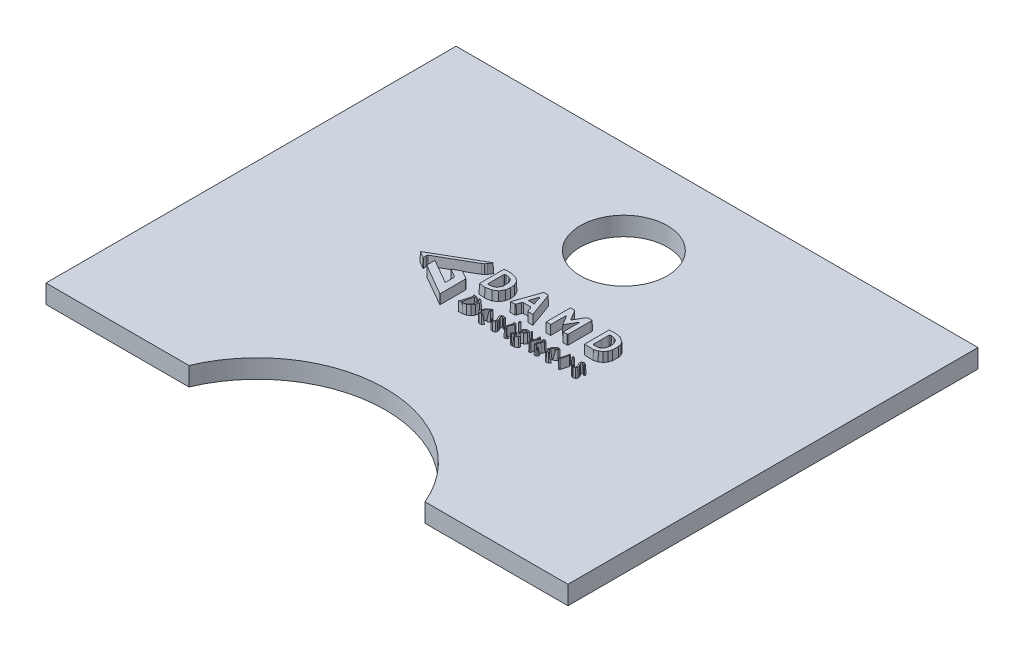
SolidWorks part; units mm, degrees
ref_plane "Front Plane" through (0, 0, 0) normal (0, 0, 1) x (1, 0, 0)
ref_plane "Top Plane" through (0, 0, 0) normal (0, 1, 0) x (1, 0, 0)
ref_plane "Right Plane" through (0, 0, 0) normal (1, 0, 0) x (0, 0, -1)
sketch "Sketch1" plane through (0, 0, 0) normal (0, 1, 0) x (1, 0, 0)
  line L0 (0, 0) -> (0, 66)
  line L1 (0, 66) -> (84, 66)
  line L2 (84, 66) -> (84, 0)
  line L3 (84, 0) -> (61, 0)
  line L4 (0, 0) -> (23, 0)
  arc A1 (23, 0) -> (61, 0) centre (42, -8) cw
  circle A2 centre (42, 51) radius 7
  dimension "D4" = 8
  dimension "D5" = 42
  dimension "D7" = 14
  dimension "D1" = 84
  dimension "D2" = 66
  dimension "D3" = 23
  dimension "D6" = 15
extrude "Boss-Extrude1" add sketch "Sketch1" along normal blind 3
sketch "Sketch14" plane through (0, 3, 0) normal (0, 1, 0) x (1, 0, 0)
  line L0 (62.5315, 12.6976) -> (23.0187, 12.6976)
  line L1 (23.0187, 12.6976) -> (23.0187, 52.3216)
  line L2 (23.0187, 52.3216) -> (23.2939, 52.3216)
  line L3 (23.2939, 52.3216) -> (62.3252, 52.3216)
  line L4 (62.3252, 52.3216) -> (62.5315, 52.3216)
  line L5 (62.5315, 52.3216) -> (62.5315, 12.6976)
  line L6 (40.8384, 30.0357) -> (41.2511, 30.3188)
  line L7 (41.2511, 30.3188) -> (41.3094, 30.6654)
  line L8 (41.3094, 30.6654) -> (41.1734, 30.7577)
  line L9 (41.1734, 30.7577) -> (40.9839, 30.7289)
  line L10 (40.9839, 30.7289) -> (40.4012, 30.2451)
  line L11 (40.4012, 30.2451) -> (40.1875, 29.5251)
  line L12 (40.1875, 29.5251) -> (40.2858, 29.2935)
  line L13 (40.2858, 29.2935) -> (40.4971, 29.189)
  line L14 (40.4971, 29.189) -> (40.8331, 29.2598)
  line L15 (40.8331, 29.2598) -> (41.0818, 29.5092)
  line L16 (41.0818, 29.5092) -> (40.7362, 29.2902)
  line L17 (40.7362, 29.2902) -> (40.4997, 29.3531)
  line L18 (40.4997, 29.3531) -> (40.4471, 29.6425)
  line L19 (40.4471, 29.6425) -> (40.5712, 29.914)
  line L20 (40.5712, 29.914) -> (40.8384, 30.0357)
  line L21 (51.4984, 29.9854) -> (52.054, 30.3426)
  line L22 (52.054, 30.3426) -> (52.0858, 30.668)
  line L23 (52.0858, 30.668) -> (51.7789, 30.7262)
  line L24 (51.7789, 30.7262) -> (51.4483, 30.5505)
  line L25 (51.4483, 30.5505) -> (51.1759, 30.2348)
  line L26 (51.1759, 30.2348) -> (50.9798, 29.4774)
  line L27 (50.9798, 29.4774) -> (51.0883, 29.2717)
  line L28 (51.0883, 29.2717) -> (51.3079, 29.189)
  line L29 (51.3079, 29.189) -> (51.63, 29.2704)
  line L30 (51.63, 29.2704) -> (51.8688, 29.4986)
  line L31 (51.8688, 29.4986) -> (51.7259, 29.3901)
  line L32 (51.7259, 29.3901) -> (51.5672, 29.3028)
  line L33 (51.5672, 29.3028) -> (51.332, 29.3101)
  line L34 (51.332, 29.3101) -> (51.2259, 29.5277)
  line L35 (51.2259, 29.5277) -> (51.2633, 29.7989)
  line L36 (51.2633, 29.7989) -> (51.4693, 29.9748)
  line L37 (51.4693, 29.9748) -> (51.4984, 29.9854)
  line L38 (47.1619, 30.7157) -> (46.7736, 30.7481)
  line L39 (46.7736, 30.7481) -> (46.429, 30.5702)
  line L40 (46.429, 30.5702) -> (46.2749, 30.1634)
  line L41 (46.2749, 30.1634) -> (46.593, 29.8796)
  line L42 (46.593, 29.8796) -> (46.6063, 29.8558)
  line L43 (46.6063, 29.8558) -> (46.3179, 29.6627)
  line L44 (46.3179, 29.6627) -> (46.2193, 29.4586)
  line L45 (46.2193, 29.4586) -> (46.3946, 29.3161)
  line L46 (46.3946, 29.3161) -> (46.8021, 29.2155)
  line L47 (46.8021, 29.2155) -> (46.9433, 29.1117)
  line L48 (46.9433, 29.1117) -> (46.8762, 28.9721)
  line L49 (46.8762, 28.9721) -> (46.3734, 28.7419)
  line L50 (46.3734, 28.7419) -> (46.1905, 28.7492)
  line L51 (46.1905, 28.7492) -> (46.0771, 28.8874)
  line L52 (46.0771, 28.8874) -> (46.1777, 29.1891)
  line L53 (46.1777, 29.1891) -> (46.2253, 29.2737)
  line L54 (46.2253, 29.2737) -> (45.958, 29.1176)
  line L55 (45.958, 29.1176) -> (45.8469, 28.8742)
  line L56 (45.8469, 28.8742) -> (46.0639, 28.7234)
  line L57 (46.0639, 28.7234) -> (46.6618, 28.7604)
  line L58 (46.6618, 28.7604) -> (47.0455, 29.0224)
  line L59 (47.0455, 29.0224) -> (47.1192, 29.2618)
  line L60 (47.1192, 29.2618) -> (46.9211, 29.4298)
  line L61 (46.9211, 29.4298) -> (46.5534, 29.5357)
  line L62 (46.5534, 29.5357) -> (46.4131, 29.6309)
  line L63 (46.4131, 29.6309) -> (46.5322, 29.7553)
  line L64 (46.5322, 29.7553) -> (46.8973, 29.922)
  line L65 (46.8973, 29.922) -> (47.2406, 30.256)
  line L66 (47.2406, 30.256) -> (47.1593, 30.721)
  line L67 (47.1593, 30.721) -> (47.2598, 30.7924)
  line L68 (47.2598, 30.7924) -> (47.4371, 30.594)
  line L69 (47.4371, 30.594) -> (47.5455, 30.6787)
  line L70 (47.5455, 30.6787) -> (47.4768, 30.8797)
  line L71 (47.4768, 30.8797) -> (47.3084, 30.881)
  line L72 (47.3084, 30.881) -> (47.1619, 30.7157)
  line L73 (33.5385, 30.7395) -> (29.6227, 32.9964)
  line L74 (29.6227, 32.9964) -> (29.62, 31.7819)
  line L75 (29.62, 31.7819) -> (29.7761, 31.5068)
  line L76 (29.7761, 31.5068) -> (34.5651, 28.7472)
  line L77 (34.5651, 28.7472) -> (34.7344, 28.6625)
  line L78 (34.7344, 28.6625) -> (34.7423, 28.7498)
  line L79 (34.7423, 28.7498) -> (34.7397, 32.7953)
  line L80 (34.7397, 32.7953) -> (34.6497, 32.9488)
  line L81 (34.6497, 32.9488) -> (33.4274, 33.6578)
  line L82 (33.4274, 33.6578) -> (33.2607, 33.6817)
  line L83 (33.2607, 33.6817) -> (32.115, 33.0202)
  line L84 (32.115, 33.0202) -> (32.3029, 32.9038)
  line L85 (32.3029, 32.9038) -> (33.4009, 32.2714)
  line L86 (33.4009, 32.2714) -> (33.5359, 32.1021)
  line L87 (33.5359, 32.1021) -> (33.5385, 30.7395)
  line L88 (50.6809, 37.2694) -> (50.0485, 37.2747)
  line L89 (50.0485, 37.2747) -> (49.7628, 37.1159)
  line L90 (49.7628, 37.1159) -> (49.0246, 35.8036)
  line L91 (49.0246, 35.8036) -> (48.8923, 35.5972)
  line L92 (48.8923, 35.5972) -> (48.7971, 35.7454)
  line L93 (48.7971, 35.7454) -> (47.961, 37.1503)
  line L94 (47.961, 37.1503) -> (47.8075, 37.2747)
  line L95 (47.8075, 37.2747) -> (47.1514, 37.28)
  line L96 (47.1514, 37.28) -> (47.1514, 33.2874)
  line L97 (47.1514, 33.2874) -> (47.9345, 33.2874)
  line L98 (47.9345, 33.2874) -> (47.9345, 35.7375)
  line L99 (47.9345, 35.7375) -> (47.9742, 35.7454)
  line L100 (47.9742, 35.7454) -> (48.9161, 34.2082)
  line L101 (48.9161, 34.2082) -> (49.8607, 35.8777)
  line L102 (49.8607, 35.8777) -> (49.9136, 35.8592)
  line L103 (49.9136, 35.8592) -> (49.9136, 33.2795)
  line L104 (49.9136, 33.2795) -> (50.4613, 33.2768)
  line L105 (50.4613, 33.2768) -> (50.6515, 33.3169)
  line L106 (50.6515, 33.3169) -> (50.6968, 33.5097)
  line L107 (50.6968, 33.5097) -> (50.6915, 37.0577)
  line L108 (50.6915, 37.0577) -> (50.6809, 37.2694)
  line L109 (36.4251, 33.2795) -> (37.4084, 33.1981)
  line L110 (37.4084, 33.1981) -> (38.3698, 33.3747)
  line L111 (38.3698, 33.3747) -> (39.0455, 33.8083)
  line L112 (39.0455, 33.8083) -> (39.4493, 34.5019)
  line L113 (39.4493, 34.5019) -> (39.5733, 35.2252)
  line L114 (39.5733, 35.2252) -> (39.489, 35.9544)
  line L115 (39.489, 35.9544) -> (39.1622, 36.6175)
  line L116 (39.1622, 36.6175) -> (38.5815, 37.0763)
  line L117 (38.5815, 37.0763) -> (37.5198, 37.3412)
  line L118 (37.5198, 37.3412) -> (36.4225, 37.2985)
  line L119 (36.4225, 37.2985) -> (36.4251, 33.2795)
  line L120 (53.3479, 33.2795) -> (54.0993, 33.1962)
  line L121 (54.0993, 33.1962) -> (54.8428, 33.2478)
  line L122 (54.8428, 33.2478) -> (55.4417, 33.4337)
  line L123 (55.4417, 33.4337) -> (55.9114, 33.7468)
  line L124 (55.9114, 33.7468) -> (56.2436, 34.1835)
  line L125 (56.2436, 34.1835) -> (56.4303, 34.74)
  line L126 (56.4303, 34.74) -> (56.4567, 35.7084)
  line L127 (56.4567, 35.7084) -> (56.3263, 36.2193)
  line L128 (56.3263, 36.2193) -> (56.0741, 36.6371)
  line L129 (56.0741, 36.6371) -> (55.2291, 37.1927)
  line L130 (55.2291, 37.1927) -> (54.2987, 37.3468)
  line L131 (54.2987, 37.3468) -> (53.3505, 37.2985)
  line L132 (53.3505, 37.2985) -> (53.3479, 33.2795)
  line L133 (45.077, 33.2742) -> (45.0638, 33.3536)
  line L134 (45.0638, 33.3536) -> (43.6774, 37.1821)
  line L135 (43.6774, 37.1821) -> (43.5583, 37.2588)
  line L136 (43.5583, 37.2588) -> (42.8624, 37.2615)
  line L137 (42.8624, 37.2615) -> (41.4363, 33.2583)
  line L138 (41.4363, 33.2583) -> (42.1983, 33.2636)
  line L139 (42.1983, 33.2636) -> (42.3095, 33.38)
  line L140 (42.3095, 33.38) -> (42.5106, 34.0097)
  line L141 (42.5106, 34.0097) -> (42.6931, 34.1473)
  line L142 (42.6931, 34.1473) -> (43.7779, 34.1473)
  line L143 (43.7779, 34.1473) -> (43.9631, 34.0124)
  line L144 (43.9631, 34.0124) -> (44.1721, 33.3853)
  line L145 (44.1721, 33.3853) -> (44.2886, 33.2769)
  line L146 (44.2886, 33.2769) -> (45.077, 33.2742)
  line L147 (28.3712, 32.3561) -> (28.3051, 32.8509)
  line L148 (28.3051, 32.8509) -> (28.3196, 33.0202)
  line L149 (28.3196, 33.0202) -> (28.4453, 33.126)
  line L150 (28.4453, 33.126) -> (33.8216, 36.2322)
  line L151 (33.8216, 36.2322) -> (34.1199, 36.4204)
  line L152 (34.1199, 36.4204) -> (34.3428, 36.6979)
  line L153 (34.3428, 36.6979) -> (34.7186, 37.3594)
  line L154 (34.7186, 37.3594) -> (27.1938, 33.007)
  line L155 (27.1938, 33.007) -> (28.3077, 32.3667)
  line L156 (28.3077, 32.3667) -> (28.3712, 32.3561)
  line L157 (37.1236, 29.2234) -> (37.7718, 29.2234)
  line L158 (37.7718, 29.2234) -> (38.3164, 29.3366)
  line L159 (38.3164, 29.3366) -> (38.7607, 29.6408)
  line L160 (38.7607, 29.6408) -> (39.0592, 30.0888)
  line L161 (39.0592, 30.0888) -> (39.1662, 30.6336)
  line L162 (39.1662, 30.6336) -> (39.0441, 31.0368)
  line L163 (39.0441, 31.0368) -> (38.682, 31.2236)
  line L164 (38.682, 31.2236) -> (37.5972, 31.2819)
  line L165 (37.5972, 31.2819) -> (37.5602, 31.2289)
  line L166 (37.5602, 31.2289) -> (37.7338, 31.1396)
  line L167 (37.7338, 31.1396) -> (37.7189, 30.967)
  line L168 (37.7189, 30.967) -> (37.3273, 29.5118)
  line L169 (37.3273, 29.5118) -> (37.1236, 29.2234)
  line L170 (48.9452, 30.1256) -> (48.9161, 30.1362)
  line L171 (48.9161, 30.1362) -> (48.9558, 30.3214)
  line L172 (48.9558, 30.3214) -> (48.9955, 30.5383)
  line L173 (48.9955, 30.5383) -> (48.928, 30.7355)
  line L174 (48.928, 30.7355) -> (48.7177, 30.7262)
  line L175 (48.7177, 30.7262) -> (48.5331, 30.538)
  line L176 (48.5331, 30.538) -> (48.4398, 30.2526)
  line L177 (48.4398, 30.2526) -> (48.6303, 30.5992)
  line L178 (48.6303, 30.5992) -> (48.7706, 30.6468)
  line L179 (48.7706, 30.6468) -> (48.8023, 30.5145)
  line L180 (48.8023, 30.5145) -> (48.76, 30.3558)
  line L181 (48.76, 30.3558) -> (48.4478, 29.234)
  line L182 (48.4478, 29.234) -> (48.678, 29.234)
  line L183 (48.678, 29.234) -> (48.7335, 29.435)
  line L184 (48.7335, 29.435) -> (48.9462, 30.0125)
  line L185 (48.9462, 30.0125) -> (49.2839, 30.5225)
  line L186 (49.2839, 30.5225) -> (49.567, 30.6468)
  line L187 (49.567, 30.6468) -> (49.5696, 30.3611)
  line L188 (49.5696, 30.3611) -> (49.2839, 29.4694)
  line L189 (49.2839, 29.4694) -> (49.3262, 29.2419)
  line L190 (49.3262, 29.2419) -> (49.5961, 29.226)
  line L191 (49.5961, 29.226) -> (49.7733, 29.3954)
  line L192 (49.7733, 29.3954) -> (49.8474, 29.6361)
  line L193 (49.8474, 29.6361) -> (49.6966, 29.3663)
  line L194 (49.6966, 29.3663) -> (49.5458, 29.2895)
  line L195 (49.5458, 29.2895) -> (49.5114, 29.4509)
  line L196 (49.5114, 29.4509) -> (49.7046, 30.0436)
  line L197 (49.7046, 30.0436) -> (49.8289, 30.4458)
  line L198 (49.8289, 30.4458) -> (49.7644, 30.711)
  line L199 (49.7644, 30.711) -> (49.4955, 30.7262)
  line L200 (49.4955, 30.7262) -> (49.1701, 30.4722)
  line L201 (49.1701, 30.4722) -> (48.9452, 30.1256)
  line L202 (56.1022, 30.7315) -> (56.1419, 30.6654)
  line L203 (56.1419, 30.6654) -> (56.1101, 30.5833)
  line L204 (56.1101, 30.5833) -> (56.1366, 30.3849)
  line L205 (56.1366, 30.3849) -> (56.2583, 30.3981)
  line L206 (56.2583, 30.3981) -> (56.2795, 30.6177)
  line L207 (56.2795, 30.6177) -> (56.1604, 30.7183)
  line L208 (56.1604, 30.7183) -> (55.8601, 30.7457)
  line L209 (55.8601, 30.7457) -> (55.6074, 30.5966)
  line L210 (55.6074, 30.5966) -> (55.5175, 30.3522)
  line L211 (55.5175, 30.3522) -> (55.6101, 30.07)
  line L212 (55.6101, 30.07) -> (55.827, 29.6917)
  line L213 (55.827, 29.6917) -> (55.7635, 29.3239)
  line L214 (55.7635, 29.3239) -> (55.4275, 29.2128)
  line L215 (55.4275, 29.2128) -> (55.4249, 29.4112)
  line L216 (55.4249, 29.4112) -> (55.3376, 29.5753)
  line L217 (55.3376, 29.5753) -> (55.245, 29.5541)
  line L218 (55.245, 29.5541) -> (55.2344, 29.3636)
  line L219 (55.2344, 29.3636) -> (55.3296, 29.2578)
  line L220 (55.3296, 29.2578) -> (55.6418, 29.192)
  line L221 (55.6418, 29.192) -> (55.9461, 29.3186)
  line L222 (55.9461, 29.3186) -> (56.0873, 29.568)
  line L223 (56.0873, 29.568) -> (56.0281, 29.869)
  line L224 (56.0281, 29.869) -> (55.7979, 30.2447)
  line L225 (55.7979, 30.2447) -> (55.8032, 30.6019)
  line L226 (55.8032, 30.6019) -> (56.1022, 30.7315)
  line L227 (43.1588, 30.7315) -> (43.1932, 30.6627)
  line L228 (43.1932, 30.6627) -> (43.1694, 30.5966)
  line L229 (43.1694, 30.5966) -> (43.1906, 30.3796)
  line L230 (43.1906, 30.3796) -> (43.3281, 30.4166)
  line L231 (43.3281, 30.4166) -> (43.307, 30.6548)
  line L232 (43.307, 30.6548) -> (43.2011, 30.7209)
  line L233 (43.2011, 30.7209) -> (42.9074, 30.7437)
  line L234 (42.9074, 30.7437) -> (42.6614, 30.6019)
  line L235 (42.6614, 30.6019) -> (42.5661, 30.3581)
  line L236 (42.5661, 30.3581) -> (42.6534, 30.0727)
  line L237 (42.6534, 30.0727) -> (42.8942, 29.6044)
  line L238 (42.8942, 29.6044) -> (42.8119, 29.2975)
  line L239 (42.8119, 29.2975) -> (42.4735, 29.2763)
  line L240 (42.4735, 29.2763) -> (42.4709, 29.4006)
  line L241 (42.4709, 29.4006) -> (42.3889, 29.5673)
  line L242 (42.3889, 29.5673) -> (42.283, 29.5382)
  line L243 (42.283, 29.5382) -> (42.2963, 29.3292)
  line L244 (42.2963, 29.3292) -> (42.373, 29.2551)
  line L245 (42.373, 29.2551) -> (42.6852, 29.187)
  line L246 (42.6852, 29.187) -> (42.9895, 29.3133)
  line L247 (42.9895, 29.3133) -> (43.133, 29.564)
  line L248 (43.133, 29.564) -> (43.0741, 29.8663)
  line L249 (43.0741, 29.8663) -> (42.8492, 30.2447)
  line L250 (42.8492, 30.2447) -> (42.8545, 30.5992)
  line L251 (42.8545, 30.5992) -> (43.1588, 30.7315)
  line L252 (44.4976, 30.5013) -> (44.7728, 30.6442)
  line L253 (44.7728, 30.6442) -> (44.7463, 30.3531)
  line L254 (44.7463, 30.3531) -> (44.704, 30.2314)
  line L255 (44.704, 30.2314) -> (44.45, 29.4853)
  line L256 (44.45, 29.4853) -> (44.5002, 29.2313)
  line L257 (44.5002, 29.2313) -> (44.7992, 29.2551)
  line L258 (44.7992, 29.2551) -> (45.0479, 29.6255)
  line L259 (45.0479, 29.6255) -> (44.8442, 29.3477)
  line L260 (44.8442, 29.3477) -> (44.704, 29.2895)
  line L261 (44.704, 29.2895) -> (44.6696, 29.4324)
  line L262 (44.6696, 29.4324) -> (44.7198, 29.5885)
  line L263 (44.7198, 29.5885) -> (45.0135, 30.4563)
  line L264 (45.0135, 30.4563) -> (44.958, 30.7103)
  line L265 (44.958, 30.7103) -> (44.6749, 30.6892)
  line L266 (44.6749, 30.6892) -> (44.4976, 30.5013)
  line L267 (53.2103, 29.2552) -> (53.25, 29.197)
  line L268 (53.25, 29.197) -> (53.4484, 29.3108)
  line L269 (53.4484, 29.3108) -> (53.7553, 30.5305)
  line L270 (53.7553, 30.5305) -> (53.7028, 30.7269)
  line L271 (53.7028, 30.7269) -> (53.4855, 30.7289)
  line L272 (53.4855, 30.7289) -> (53.2288, 30.3162)
  line L273 (53.2288, 30.3162) -> (53.3876, 30.6019)
  line L274 (53.3876, 30.6019) -> (53.5146, 30.6522)
  line L275 (53.5146, 30.6522) -> (53.5543, 30.5252)
  line L276 (53.5543, 30.5252) -> (53.5172, 30.3665)
  line L277 (53.5172, 30.3665) -> (53.2103, 29.2552)
  line L278 (45.0373, 30.9935) -> (45.2146, 31.2793)
  line L279 (45.2146, 31.2793) -> (45.0638, 31.4142)
  line L280 (45.0638, 31.4142) -> (44.8891, 31.1893)
  line L281 (44.8891, 31.1893) -> (45.0373, 30.9935)
  line L282 (54.1628, 30.6866) -> (54.1496, 30.422)
  line L283 (54.1496, 30.422) -> (54.3427, 30.4538)
  line L284 (54.3427, 30.4538) -> (54.3798, 30.6787)
  line L285 (54.3798, 30.6787) -> (54.2369, 30.7561)
  line L286 (54.2369, 30.7561) -> (54.0543, 30.6866)
  line L287 (54.0543, 30.6866) -> (54.1628, 30.6866)
  line L288 (62.5315, 12.6976) -> (62.5315, 52.3216)
  line L289 (62.5315, 52.3216) -> (62.3251, 52.3216)
  line L290 (62.3251, 52.3216) -> (23.2938, 52.3216)
  line L291 (23.2938, 52.3216) -> (23.0187, 52.3216)
  line L292 (23.0187, 52.3216) -> (23.0372, 52.356)
  line L293 (23.0372, 52.356) -> (23.1853, 52.3586)
  line L294 (23.1853, 52.3586) -> (62.5711, 52.3586)
  line L295 (62.5711, 52.3586) -> (62.5711, 52.0729)
  line L296 (62.5711, 52.0729) -> (62.5685, 12.8617)
  line L297 (62.5685, 12.8617) -> (62.5315, 12.6976)
  line L298 (33.5385, 30.7395) -> (33.5332, 32.0995)
  line L299 (33.5332, 32.0995) -> (33.3983, 32.2688)
  line L300 (33.3983, 32.2688) -> (32.3003, 32.9011)
  line L301 (32.3003, 32.9011) -> (32.1124, 33.0176)
  line L302 (32.1124, 33.0176) -> (33.258, 33.679)
  line L303 (33.258, 33.679) -> (33.4247, 33.6552)
  line L304 (33.4247, 33.6552) -> (34.6471, 32.9461)
  line L305 (34.6471, 32.9461) -> (34.7371, 32.7927)
  line L306 (34.7371, 32.7927) -> (34.7397, 28.7472)
  line L307 (34.7397, 28.7472) -> (34.7318, 28.6599)
  line L308 (34.7318, 28.6599) -> (34.5624, 28.7446)
  line L309 (34.5624, 28.7446) -> (29.7735, 31.5042)
  line L310 (29.7735, 31.5042) -> (29.6174, 31.7793)
  line L311 (29.6174, 31.7793) -> (29.62, 32.9938)
  line L312 (29.62, 32.9938) -> (33.5385, 30.7395)
  line L313 (50.6809, 37.2694) -> (50.6915, 37.0524)
  line L314 (50.6915, 37.0524) -> (50.6968, 33.5044)
  line L315 (50.6968, 33.5044) -> (50.6495, 33.3116)
  line L316 (50.6495, 33.3116) -> (50.4613, 33.2715)
  line L317 (50.4613, 33.2715) -> (49.9136, 33.2742)
  line L318 (49.9136, 33.2742) -> (49.9136, 35.8539)
  line L319 (49.9136, 35.8539) -> (49.8607, 35.8724)
  line L320 (49.8607, 35.8724) -> (48.9161, 34.2029)
  line L321 (48.9161, 34.2029) -> (47.9742, 35.7401)
  line L322 (47.9742, 35.7401) -> (47.9345, 35.7322)
  line L323 (47.9345, 35.7322) -> (47.9345, 33.2821)
  line L324 (47.9345, 33.2821) -> (47.1514, 33.2821)
  line L325 (47.1514, 33.2821) -> (47.1514, 37.2747)
  line L326 (47.1514, 37.2747) -> (47.8075, 37.2694)
  line L327 (47.8075, 37.2694) -> (47.961, 37.145)
  line L328 (47.961, 37.145) -> (48.7971, 35.7401)
  line L329 (48.7971, 35.7401) -> (48.8923, 35.5919)
  line L330 (48.8923, 35.5919) -> (49.0246, 35.7983)
  line L331 (49.0246, 35.7983) -> (49.7628, 37.1106)
  line L332 (49.7628, 37.1106) -> (50.0485, 37.2694)
  line L333 (50.0485, 37.2694) -> (50.6809, 37.2694)
  line L334 (36.4251, 33.2795) -> (36.4251, 37.2985)
  line L335 (36.4251, 37.2985) -> (37.5205, 37.3412)
  line L336 (37.5205, 37.3412) -> (38.5841, 37.0763)
  line L337 (38.5841, 37.0763) -> (39.1649, 36.6175)
  line L338 (39.1649, 36.6175) -> (39.4916, 35.9544)
  line L339 (39.4916, 35.9544) -> (39.576, 35.2262)
  line L340 (39.576, 35.2262) -> (39.4519, 34.5019)
  line L341 (39.4519, 34.5019) -> (39.0481, 33.8083)
  line L342 (39.0481, 33.8083) -> (38.3724, 33.3748)
  line L343 (38.3724, 33.3748) -> (37.4087, 33.1971)
  line L344 (37.4087, 33.1971) -> (36.4251, 33.2795)
  line L345 (37.2083, 33.9224) -> (37.5867, 33.8986)
  line L346 (37.5867, 33.8986) -> (38.3248, 34.1413)
  line L347 (38.3248, 34.1413) -> (38.7138, 34.8088)
  line L348 (38.7138, 34.8088) -> (38.6688, 35.8248)
  line L349 (38.6688, 35.8248) -> (38.39, 36.2951)
  line L350 (38.39, 36.2951) -> (37.9068, 36.5471)
  line L351 (37.9068, 36.5471) -> (37.3988, 36.6159)
  line L352 (37.3988, 36.6159) -> (37.2328, 36.5844)
  line L353 (37.2328, 36.5844) -> (37.1898, 36.4121)
  line L354 (37.1898, 36.4121) -> (37.1951, 34.1129)
  line L355 (37.1951, 34.1129) -> (37.2083, 33.9224)
  line L356 (53.3479, 33.2795) -> (53.3479, 37.2959)
  line L357 (53.3479, 37.2959) -> (54.2971, 37.3442)
  line L358 (54.2971, 37.3442) -> (55.2264, 37.19)
  line L359 (55.2264, 37.19) -> (56.0715, 36.6344)
  line L360 (56.0715, 36.6344) -> (56.3237, 36.2167)
  line L361 (56.3237, 36.2167) -> (56.4541, 35.7057)
  line L362 (56.4541, 35.7057) -> (56.4277, 34.7374)
  line L363 (56.4277, 34.7374) -> (56.241, 34.1809)
  line L364 (56.241, 34.1809) -> (55.9087, 33.7442)
  line L365 (55.9087, 33.7442) -> (55.4391, 33.431)
  line L366 (55.4391, 33.431) -> (54.8402, 33.2451)
  line L367 (54.8402, 33.2451) -> (53.3479, 33.2795)
  line L368 (54.1152, 35.2665) -> (54.1178, 34.0891)
  line L369 (54.1178, 34.0891) -> (54.2025, 33.9224)
  line L370 (54.2025, 33.9224) -> (55.0383, 34.0117)
  line L371 (55.0383, 34.0117) -> (55.3675, 34.2536)
  line L372 (55.3675, 34.2536) -> (55.5863, 34.6368)
  line L373 (55.5863, 34.6368) -> (55.6802, 35.2232)
  line L374 (55.6802, 35.2232) -> (55.5916, 35.8115)
  line L375 (55.5916, 35.8115) -> (55.3128, 36.2914)
  line L376 (55.3128, 36.2914) -> (54.8216, 36.5471)
  line L377 (54.8216, 36.5471) -> (54.3507, 36.6159)
  line L378 (54.3507, 36.6159) -> (54.1598, 36.5855)
  line L379 (54.1598, 36.5855) -> (54.1099, 36.3883)
  line L380 (54.1099, 36.3883) -> (54.1152, 35.2665)
  line L381 (45.077, 33.2742) -> (44.2912, 33.2795)
  line L382 (44.2912, 33.2795) -> (44.1748, 33.388)
  line L383 (44.1748, 33.388) -> (43.9657, 34.015)
  line L384 (43.9657, 34.015) -> (43.7805, 34.15)
  line L385 (43.7805, 34.15) -> (42.6958, 34.15)
  line L386 (42.6958, 34.15) -> (42.5132, 34.0124)
  line L387 (42.5132, 34.0124) -> (42.3121, 33.3827)
  line L388 (42.3121, 33.3827) -> (42.201, 33.2663)
  line L389 (42.201, 33.2663) -> (41.439, 33.261)
  line L390 (41.439, 33.261) -> (42.8651, 37.2641)
  line L391 (42.8651, 37.2641) -> (43.5609, 37.2615)
  line L392 (43.5609, 37.2615) -> (43.68, 37.1847)
  line L393 (43.68, 37.1847) -> (45.0664, 33.3562)
  line L394 (45.0664, 33.3562) -> (45.077, 33.2742)
  line L395 (43.2567, 36.1952) -> (43.2091, 36.1952)
  line L396 (43.2091, 36.1952) -> (42.7937, 34.8749)
  line L397 (42.7937, 34.8749) -> (43.6853, 34.8749)
  line L398 (43.6853, 34.8749) -> (43.2567, 36.1952)
  line L399 (28.3712, 32.3561) -> (28.3051, 32.3667)
  line L400 (28.3051, 32.3667) -> (27.1912, 33.007)
  line L401 (27.1912, 33.007) -> (34.7159, 37.3594)
  line L402 (34.7159, 37.3594) -> (34.3402, 36.6979)
  line L403 (34.3402, 36.6979) -> (34.1173, 36.4204)
  line L404 (34.1173, 36.4204) -> (33.819, 36.2322)
  line L405 (33.819, 36.2322) -> (28.4426, 33.126)
  line L406 (28.4426, 33.126) -> (28.317, 33.0202)
  line L407 (28.317, 33.0202) -> (28.3024, 32.8509)
  line L408 (28.3024, 32.8509) -> (28.3712, 32.3561)
  line L409 (37.1236, 29.2234) -> (37.322, 29.5144)
  line L410 (37.322, 29.5144) -> (37.7136, 30.9697)
  line L411 (37.7136, 30.9697) -> (37.7285, 31.1423)
  line L412 (37.7285, 31.1423) -> (37.5549, 31.2316)
  line L413 (37.5549, 31.2316) -> (37.5919, 31.2845)
  line L414 (37.5919, 31.2845) -> (38.6767, 31.2263)
  line L415 (38.6767, 31.2263) -> (39.0398, 31.0384)
  line L416 (39.0398, 31.0384) -> (39.1609, 30.6363)
  line L417 (39.1609, 30.6363) -> (39.055, 30.0904)
  line L418 (39.055, 30.0904) -> (38.7564, 29.6424)
  line L419 (38.7564, 29.6424) -> (38.3115, 29.3389)
  line L420 (38.3115, 29.3389) -> (37.7665, 29.226)
  line L421 (37.7665, 29.226) -> (37.1236, 29.2234)
  line L422 (38.3513, 31.221) -> (38.1214, 31.1998)
  line L423 (38.1214, 31.1998) -> (37.9809, 31.012)
  line L424 (37.9809, 31.012) -> (37.5734, 29.488)
  line L425 (37.5734, 29.488) -> (37.5857, 29.32)
  line L426 (37.5857, 29.32) -> (37.7428, 29.271)
  line L427 (37.7428, 29.271) -> (38.311, 29.4132)
  line L428 (38.311, 29.4132) -> (38.6926, 29.8452)
  line L429 (38.6926, 29.8452) -> (38.8963, 30.5807)
  line L430 (38.8963, 30.5807) -> (38.8044, 31.0467)
  line L431 (38.8044, 31.0467) -> (38.3513, 31.221)
  line L432 (48.9452, 30.1256) -> (49.1675, 30.4775)
  line L433 (49.1675, 30.4775) -> (49.4929, 30.7315)
  line L434 (49.4929, 30.7315) -> (49.7618, 30.7163)
  line L435 (49.7618, 30.7163) -> (49.8263, 30.451)
  line L436 (49.8263, 30.451) -> (49.7019, 30.0489)
  line L437 (49.7019, 30.0489) -> (49.5088, 29.4562)
  line L438 (49.5088, 29.4562) -> (49.5432, 29.2948)
  line L439 (49.5432, 29.2948) -> (49.694, 29.3715)
  line L440 (49.694, 29.3715) -> (49.8448, 29.6414)
  line L441 (49.8448, 29.6414) -> (49.7717, 29.4016)
  line L442 (49.7717, 29.4016) -> (49.5934, 29.2313)
  line L443 (49.5934, 29.2313) -> (49.3236, 29.2472)
  line L444 (49.3236, 29.2472) -> (49.2812, 29.4747)
  line L445 (49.2812, 29.4747) -> (49.567, 30.3664)
  line L446 (49.567, 30.3664) -> (49.5643, 30.6521)
  line L447 (49.5643, 30.6521) -> (49.2812, 30.5278)
  line L448 (49.2812, 30.5278) -> (48.9426, 30.0178)
  line L449 (48.9426, 30.0178) -> (48.7309, 29.4403)
  line L450 (48.7309, 29.4403) -> (48.6753, 29.2392)
  line L451 (48.6753, 29.2392) -> (48.4451, 29.2392)
  line L452 (48.4451, 29.2392) -> (48.7573, 30.3611)
  line L453 (48.7573, 30.3611) -> (48.7997, 30.5198)
  line L454 (48.7997, 30.5198) -> (48.7679, 30.6521)
  line L455 (48.7679, 30.6521) -> (48.6277, 30.6045)
  line L456 (48.6277, 30.6045) -> (48.4372, 30.2579)
  line L457 (48.4372, 30.2579) -> (48.5315, 30.5433)
  line L458 (48.5315, 30.5433) -> (48.715, 30.7315)
  line L459 (48.715, 30.7315) -> (48.9254, 30.7408)
  line L460 (48.9254, 30.7408) -> (48.9928, 30.5436)
  line L461 (48.9928, 30.5436) -> (48.9531, 30.3267)
  line L462 (48.9531, 30.3267) -> (48.9134, 30.1415)
  line L463 (48.9134, 30.1415) -> (48.9452, 30.1256)
  line L464 (47.1593, 30.7183) -> (47.2407, 30.2533)
  line L465 (47.2407, 30.2533) -> (46.8974, 29.9193)
  line L466 (46.8974, 29.9193) -> (46.5322, 29.7526)
  line L467 (46.5322, 29.7526) -> (46.4132, 29.6282)
  line L468 (46.4132, 29.6282) -> (46.5534, 29.533)
  line L469 (46.5534, 29.533) -> (46.9212, 29.4271)
  line L470 (46.9212, 29.4271) -> (47.1193, 29.2591)
  line L471 (47.1193, 29.2591) -> (47.0455, 29.0197)
  line L472 (47.0455, 29.0197) -> (46.6619, 28.7577)
  line L473 (46.6619, 28.7577) -> (46.0639, 28.7207)
  line L474 (46.0639, 28.7207) -> (45.847, 28.8715)
  line L475 (45.847, 28.8715) -> (45.9581, 29.1149)
  line L476 (45.9581, 29.1149) -> (46.2253, 29.271)
  line L477 (46.2253, 29.271) -> (46.1777, 29.1864)
  line L478 (46.1777, 29.1864) -> (46.0772, 28.8847)
  line L479 (46.0772, 28.8847) -> (46.1906, 28.7465)
  line L480 (46.1906, 28.7465) -> (46.3735, 28.7392)
  line L481 (46.3735, 28.7392) -> (46.8762, 28.9694)
  line L482 (46.8762, 28.9694) -> (46.9433, 29.11)
  line L483 (46.9433, 29.11) -> (46.8021, 29.2128)
  line L484 (46.8021, 29.2128) -> (46.3947, 29.3134)
  line L485 (46.3947, 29.3134) -> (46.2184, 29.4569)
  line L486 (46.2184, 29.4569) -> (46.3179, 29.66)
  line L487 (46.3179, 29.66) -> (46.6063, 29.8531)
  line L488 (46.6063, 29.8531) -> (46.5931, 29.8769)
  line L489 (46.5931, 29.8769) -> (46.2749, 30.1607)
  line L490 (46.2749, 30.1607) -> (46.4291, 30.5675)
  line L491 (46.4291, 30.5675) -> (46.7737, 30.7454)
  line L492 (46.7737, 30.7454) -> (47.1619, 30.713)
  line L493 (47.1619, 30.713) -> (47.1593, 30.7183)
  line L494 (46.474, 30.1547) -> (46.601, 29.9563)
  line L495 (46.601, 29.9563) -> (46.8629, 30.0145)
  line L496 (46.8629, 30.0145) -> (47.0296, 30.4669)
  line L497 (47.0296, 30.4669) -> (46.9529, 30.6812)
  line L498 (46.9529, 30.6812) -> (46.6804, 30.6045)
  line L499 (46.6804, 30.6045) -> (46.474, 30.1547)
  line L500 (51.472, 29.9748) -> (51.266, 29.7989)
  line L501 (51.266, 29.7989) -> (51.2286, 29.5277)
  line L502 (51.2286, 29.5277) -> (51.3357, 29.31)
  line L503 (51.3357, 29.31) -> (51.5699, 29.3028)
  line L504 (51.5699, 29.3028) -> (51.7286, 29.3901)
  line L505 (51.7286, 29.3901) -> (51.8715, 29.4986)
  line L506 (51.8715, 29.4986) -> (51.6337, 29.2703)
  line L507 (51.6337, 29.2703) -> (51.3106, 29.189)
  line L508 (51.3106, 29.189) -> (51.09, 29.2717)
  line L509 (51.09, 29.2717) -> (50.9825, 29.4774)
  line L510 (50.9825, 29.4774) -> (51.1777, 30.2348)
  line L511 (51.1777, 30.2348) -> (51.4506, 30.5504)
  line L512 (51.4506, 30.5504) -> (51.7816, 30.7262)
  line L513 (51.7816, 30.7262) -> (52.0885, 30.668)
  line L514 (52.0885, 30.668) -> (52.0567, 30.3426)
  line L515 (52.0567, 30.3426) -> (51.5011, 29.9854)
  line L516 (51.5011, 29.9854) -> (51.8593, 30.2883)
  line L517 (51.8593, 30.2883) -> (51.89, 30.6865)
  line L518 (51.89, 30.6865) -> (51.4985, 30.4173)
  line L519 (51.4985, 30.4173) -> (51.3212, 29.9139)
  line L520 (51.3212, 29.9139) -> (51.472, 29.9748)
  line L521 (56.1022, 30.7315) -> (55.7979, 30.5992)
  line L522 (55.7979, 30.5992) -> (55.7926, 30.242)
  line L523 (55.7926, 30.242) -> (56.0228, 29.8663)
  line L524 (56.0228, 29.8663) -> (56.081, 29.5644)
  line L525 (56.081, 29.5644) -> (55.9408, 29.316)
  line L526 (55.9408, 29.316) -> (55.6365, 29.1893)
  line L527 (55.6365, 29.1893) -> (55.3243, 29.2551)
  line L528 (55.3243, 29.2551) -> (55.2291, 29.361)
  line L529 (55.2291, 29.361) -> (55.2397, 29.5515)
  line L530 (55.2397, 29.5515) -> (55.3323, 29.5726)
  line L531 (55.3323, 29.5726) -> (55.4196, 29.4086)
  line L532 (55.4196, 29.4086) -> (55.4222, 29.2101)
  line L533 (55.4222, 29.2101) -> (55.7582, 29.3213)
  line L534 (55.7582, 29.3213) -> (55.8217, 29.689)
  line L535 (55.8217, 29.689) -> (55.6048, 30.0674)
  line L536 (55.6048, 30.0674) -> (55.5122, 30.3495)
  line L537 (55.5122, 30.3495) -> (55.6021, 30.5939)
  line L538 (55.6021, 30.5939) -> (55.8548, 30.7431)
  line L539 (55.8548, 30.7431) -> (56.1551, 30.7156)
  line L540 (56.1551, 30.7156) -> (56.2742, 30.6151)
  line L541 (56.2742, 30.6151) -> (56.253, 30.3955)
  line L542 (56.253, 30.3955) -> (56.1313, 30.3822)
  line L543 (56.1313, 30.3822) -> (56.1048, 30.5807)
  line L544 (56.1048, 30.5807) -> (56.1366, 30.6627)
  line L545 (56.1366, 30.6627) -> (56.1022, 30.7315)
  line L546 (40.5712, 29.9166) -> (40.4472, 29.6441)
  line L547 (40.4472, 29.6441) -> (40.4998, 29.3557)
  line L548 (40.4998, 29.3557) -> (40.7362, 29.2919)
  line L549 (40.7362, 29.2919) -> (41.0818, 29.5118)
  line L550 (41.0818, 29.5118) -> (40.8331, 29.2624)
  line L551 (40.8331, 29.2624) -> (40.4971, 29.1916)
  line L552 (40.4971, 29.1916) -> (40.2858, 29.2962)
  line L553 (40.2858, 29.2962) -> (40.1876, 29.5277)
  line L554 (40.1876, 29.5277) -> (40.4022, 30.2487)
  line L555 (40.4022, 30.2487) -> (40.984, 30.7315)
  line L556 (40.984, 30.7315) -> (41.1745, 30.7603)
  line L557 (41.1745, 30.7603) -> (41.3094, 30.668)
  line L558 (41.3094, 30.668) -> (41.2512, 30.3214)
  line L559 (41.2512, 30.3214) -> (40.8384, 30.0383)
  line L560 (40.8384, 30.0383) -> (41.0425, 30.2453)
  line L561 (41.0425, 30.2453) -> (41.1295, 30.5198)
  line L562 (41.1295, 30.5198) -> (41.0977, 30.6918)
  line L563 (41.0977, 30.6918) -> (40.9178, 30.6389)
  line L564 (40.9178, 30.6389) -> (40.5183, 29.996)
  line L565 (40.5183, 29.996) -> (40.5712, 29.9166)
  line L566 (43.1588, 30.7315) -> (42.8598, 30.6019)
  line L567 (42.8598, 30.6019) -> (42.8545, 30.2473)
  line L568 (42.8545, 30.2473) -> (43.0794, 29.869)
  line L569 (43.0794, 29.869) -> (43.1363, 29.5667)
  line L570 (43.1363, 29.5667) -> (42.9948, 29.316)
  line L571 (42.9948, 29.316) -> (42.6905, 29.1906)
  line L572 (42.6905, 29.1906) -> (42.3783, 29.2578)
  line L573 (42.3783, 29.2578) -> (42.3016, 29.3319)
  line L574 (42.3016, 29.3319) -> (42.2883, 29.5409)
  line L575 (42.2883, 29.5409) -> (42.3942, 29.57)
  line L576 (42.3942, 29.57) -> (42.4762, 29.4033)
  line L577 (42.4762, 29.4033) -> (42.4788, 29.2789)
  line L578 (42.4788, 29.2789) -> (42.8172, 29.3001)
  line L579 (42.8172, 29.3001) -> (42.8995, 29.607)
  line L580 (42.8995, 29.607) -> (42.6587, 30.0753)
  line L581 (42.6587, 30.0753) -> (42.5714, 30.3598)
  line L582 (42.5714, 30.3598) -> (42.6667, 30.6045)
  line L583 (42.6667, 30.6045) -> (42.9127, 30.7464)
  line L584 (42.9127, 30.7464) -> (43.2064, 30.7236)
  line L585 (43.2064, 30.7236) -> (43.3123, 30.6574)
  line L586 (43.3123, 30.6574) -> (43.3334, 30.4193)
  line L587 (43.3334, 30.4193) -> (43.1958, 30.3823)
  line L588 (43.1958, 30.3823) -> (43.1747, 30.5992)
  line L589 (43.1747, 30.5992) -> (43.1985, 30.6654)
  line L590 (43.1985, 30.6654) -> (43.1588, 30.7315)
  line L591 (44.4976, 30.5013) -> (44.6696, 30.6892)
  line L592 (44.6696, 30.6892) -> (44.9527, 30.7103)
  line L593 (44.9527, 30.7103) -> (45.0082, 30.4563)
  line L594 (45.0082, 30.4563) -> (44.7146, 29.5885)
  line L595 (44.7146, 29.5885) -> (44.6643, 29.4324)
  line L596 (44.6643, 29.4324) -> (44.6987, 29.2895)
  line L597 (44.6987, 29.2895) -> (44.8389, 29.3477)
  line L598 (44.8389, 29.3477) -> (45.0426, 29.6255)
  line L599 (45.0426, 29.6255) -> (44.7939, 29.2551)
  line L600 (44.7939, 29.2551) -> (44.495, 29.2313)
  line L601 (44.495, 29.2313) -> (44.4447, 29.4853)
  line L602 (44.4447, 29.4853) -> (44.6987, 30.2314)
  line L603 (44.6987, 30.2314) -> (44.741, 30.3531)
  line L604 (44.741, 30.3531) -> (44.7675, 30.6442)
  line L605 (44.7675, 30.6442) -> (44.4976, 30.5013)
  line L606 (53.2103, 29.2552) -> (53.5225, 30.3638)
  line L607 (53.5225, 30.3638) -> (53.5596, 30.5225)
  line L608 (53.5596, 30.5225) -> (53.5199, 30.6496)
  line L609 (53.5199, 30.6496) -> (53.3929, 30.5993)
  line L610 (53.3929, 30.5993) -> (53.2341, 30.3135)
  line L611 (53.2341, 30.3135) -> (53.4908, 30.7263)
  line L612 (53.4908, 30.7263) -> (53.708, 30.7243)
  line L613 (53.708, 30.7243) -> (53.7606, 30.5278)
  line L614 (53.7606, 30.5278) -> (53.4537, 29.3081)
  line L615 (53.4537, 29.3081) -> (53.2553, 29.1943)
  line L616 (53.2553, 29.1943) -> (53.2103, 29.2552)
  line L617 (40.5712, 29.9166) -> (40.5209, 29.9933)
  line L618 (40.5209, 29.9933) -> (40.9204, 30.6363)
  line L619 (40.9204, 30.6363) -> (41.1004, 30.6892)
  line L620 (41.1004, 30.6892) -> (41.1321, 30.5172)
  line L621 (41.1321, 30.5172) -> (41.0451, 30.2427)
  line L622 (41.0451, 30.2427) -> (40.8411, 30.0357)
  line L623 (40.8411, 30.0357) -> (40.5712, 29.9166)
  line L624 (51.472, 29.9748) -> (51.3212, 29.9139)
  line L625 (51.3212, 29.9139) -> (51.4995, 30.4173)
  line L626 (51.4995, 30.4173) -> (51.89, 30.6865)
  line L627 (51.89, 30.6865) -> (51.8593, 30.2883)
  line L628 (51.8593, 30.2883) -> (51.5011, 29.9854)
  line L629 (51.5011, 29.9854) -> (51.472, 29.9748)
  line L630 (45.0373, 30.9935) -> (44.8891, 31.1893)
  line L631 (44.8891, 31.1893) -> (45.0638, 31.4142)
  line L632 (45.0638, 31.4142) -> (45.2146, 31.2793)
  line L633 (45.2146, 31.2793) -> (45.0373, 30.9935)
  line L634 (54.1628, 30.6866) -> (54.0543, 30.6866)
  line L635 (54.0543, 30.6866) -> (54.2359, 30.7561)
  line L636 (54.2359, 30.7561) -> (54.3798, 30.6787)
  line L637 (54.3798, 30.6787) -> (54.3427, 30.4538)
  line L638 (54.3427, 30.4538) -> (54.1496, 30.422)
  line L639 (54.1496, 30.422) -> (54.1628, 30.6866)
  line L640 (47.1619, 30.7157) -> (47.3074, 30.8811)
  line L641 (47.3074, 30.8811) -> (47.4768, 30.8797)
  line L642 (47.4768, 30.8797) -> (47.5455, 30.6787)
  line L643 (47.5455, 30.6787) -> (47.4371, 30.594)
  line L644 (47.4371, 30.594) -> (47.2598, 30.7924)
  line L645 (47.2598, 30.7924) -> (47.1593, 30.721)
  line L646 (47.1593, 30.721) -> (47.1619, 30.7157)
  line L647 (37.2083, 33.9224) -> (37.1951, 34.1155)
  line L648 (37.1951, 34.1155) -> (37.1898, 36.4148)
  line L649 (37.1898, 36.4148) -> (37.2328, 36.5861)
  line L650 (37.2328, 36.5861) -> (37.3988, 36.6185)
  line L651 (37.3988, 36.6185) -> (37.9068, 36.5497)
  line L652 (37.9068, 36.5497) -> (38.389, 36.2977)
  line L653 (38.389, 36.2977) -> (38.6688, 35.8274)
  line L654 (38.6688, 35.8274) -> (38.7138, 34.8114)
  line L655 (38.7138, 34.8114) -> (38.3248, 34.143)
  line L656 (38.3248, 34.143) -> (37.5867, 33.9012)
  line L657 (37.5867, 33.9012) -> (37.2083, 33.9224)
  line L658 (54.1152, 35.2665) -> (54.1099, 36.3883)
  line L659 (54.1099, 36.3883) -> (54.1598, 36.5855)
  line L660 (54.1598, 36.5855) -> (54.3507, 36.6159)
  line L661 (54.3507, 36.6159) -> (54.8216, 36.5471)
  line L662 (54.8216, 36.5471) -> (55.3128, 36.2914)
  line L663 (55.3128, 36.2914) -> (55.5916, 35.8115)
  line L664 (55.5916, 35.8115) -> (55.6802, 35.2232)
  line L665 (55.6802, 35.2232) -> (55.5863, 34.6368)
  line L666 (55.5863, 34.6368) -> (55.3675, 34.2547)
  line L667 (55.3675, 34.2547) -> (55.0383, 34.0127)
  line L668 (55.0383, 34.0127) -> (54.2025, 33.9224)
  line L669 (54.2025, 33.9224) -> (54.1178, 34.0891)
  line L670 (54.1178, 34.0891) -> (54.1152, 35.2665)
  line L671 (43.2567, 36.1952) -> (43.6853, 34.8749)
  line L672 (43.6853, 34.8749) -> (42.7937, 34.8749)
  line L673 (42.7937, 34.8749) -> (43.2091, 36.1952)
  line L674 (43.2091, 36.1952) -> (43.2567, 36.1952)
  line L675 (38.3513, 31.221) -> (38.8064, 31.0474)
  line L676 (38.8064, 31.0474) -> (38.8963, 30.5781)
  line L677 (38.8963, 30.5781) -> (38.6926, 29.8425)
  line L678 (38.6926, 29.8425) -> (38.311, 29.4116)
  line L679 (38.311, 29.4116) -> (37.7428, 29.2684)
  line L680 (37.7428, 29.2684) -> (37.5857, 29.3173)
  line L681 (37.5857, 29.3173) -> (37.5734, 29.4853)
  line L682 (37.5734, 29.4853) -> (37.9809, 31.0093)
  line L683 (37.9809, 31.0093) -> (38.1214, 31.1985)
  line L684 (38.1214, 31.1985) -> (38.3513, 31.221)
  line L685 (46.474, 30.1547) -> (46.6804, 30.6045)
  line L686 (46.6804, 30.6045) -> (46.9529, 30.6812)
  line L687 (46.9529, 30.6812) -> (47.0296, 30.4669)
  line L688 (47.0296, 30.4669) -> (46.8629, 30.0145)
  line L689 (46.8629, 30.0145) -> (46.601, 29.9563)
  line L690 (46.601, 29.9563) -> (46.474, 30.1547)
extrude "Boss-Extrude3" add sketch "Sketch14" along normal blind 1.5 draft 1 separate body contours L312 L74 L75 L76 L77 L307 L306 L305 L304 L303 L302 L84 L85 L86 L87 | L408 L407 L406 L405 L404 L403 L402 L154 L155 L156 | L335 L334 L109 L110 L111 L112 L113 L114 L115 L116 L117 L654 L655 L348 L347 L346 L345 L355 L354 L648 L649 L650 L651 L652 L653 | L390 L389 L139 L140 L141 L387 L386 L385 L384 L383 L382 L381 L133 L134 L135 L136 L398 L397 L396 L395 | L333 L332 L331 L330 L329 L328 L327 L326 L96 L97 L98 L99 L100 L101 L102 L103 L104 L105 L315 L106 L107 L313 | L367 L121 L122 L123 L364 L363 L362 L361 L360 L359 L358 L357 L132 L380 L379 L378 L377 L376 L375 L374 L373 L372 L371 L370 L369 L368 | L421 L420 L419 L418 L417 L416 L415 L164 L165 L166 L167 L168 L169 L681 L682 L425 L424 L423 L422 L675 L676 L430 L429 L677 L678 L679 L680 | L621 L622 L559 L558 L8 L9 L10 L11 L553 L552 L551 L550 L16 L17 L18 L19 L547 L546 L565 L564 L563 L562 L619 L620 | L583 L582 L581 L580 L579 L578 L238 L239 L240 L241 L242 L574 L573 L572 L571 L247 L248 L249 L250 L251 L567 L566 L233 | L590 L589 L588 L587 L231 L232 L233 | L605 L604 L252 L253 L254 L255 L256 L600 L599 L259 L260 L261 L597 L596 L595 L594 L593 L265 L266 | L280 L281 L278 L279 | L492 L491 L490 L41 L42 L43 L488 L487 L486 L44 L45 L46 L47 L48 L483 L482 L481 L57 L58 L59 L470 L469 L468 L467 L62 L63 L64 L65 L464 L499 L498 L497 L496 L495 L494 | L480 L479 L478 L51 L52 L53 L476 L475 L56 L57 | L71 L72 L67 L68 L69 L70 | L463 L462 L461 L460 L174 L175 L176 L456 L455 L454 L178 L179 L180 L181 L451 L450 L449 L448 L447 L446 L186 L187 L188 L189 L443 L442 L441 L193 L194 L195 L439 L438 L437 L436 L435 L199 L200 L201 L170 L171 | L520 L519 L518 L517 L516 L21 L22 L23 L512 L511 L510 L509 L508 L29 L30 L505 L504 L503 L32 L33 L34 L35 L36 | L636 L286 L287 L282 L283 L284 | L616 L268 L269 L270 L612 L611 L274 L275 L609 L608 L607 L606 | L539 L209 L210 L211 L212 L213 L214 L534 L533 L220 L221 L525 L524 L523 L522 L521 L225 L226 | L541 L540 L539 L202 L203 L204 L205 | L532 L531 L530 L218 L219 L220
